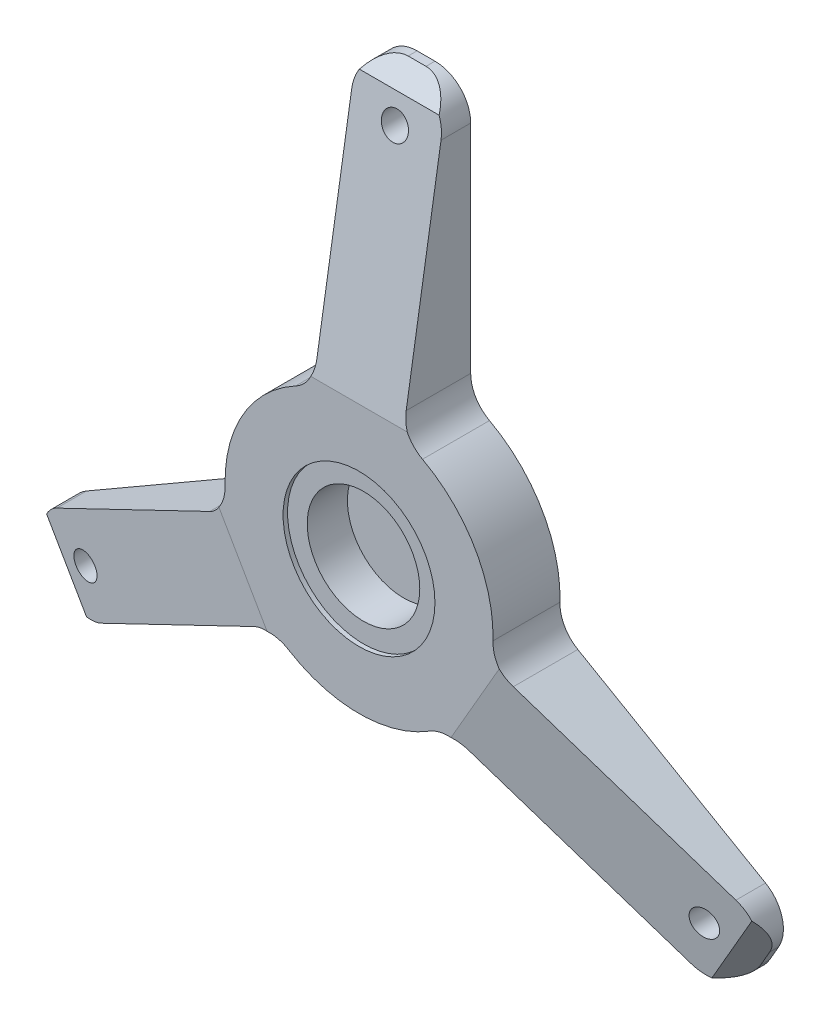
SolidWorks part; units mm, degrees
ref_plane "Спереди" through (0, 0, 0) normal (0, 0, 1) x (1, 0, 0)
ref_plane "Сверху" through (0, 0, 0) normal (0, 1, 0) x (1, 0, 0)
ref_plane "Справа" through (0, 0, 0) normal (1, 0, 0) x (0, 0, -1)
sketch "Эскиз1" plane through (0, 0, 0) normal (0, 0, 1) x (1, 0, 0)
  circle A0 centre (0, 0) radius 30
  dimension "D1" = 60
extrude "Бобышка-Вытянуть1" add sketch "Эскиз1" along normal blind 15
sketch "Эскиз2" plane through (0, 0, 0) normal (1, 0, 0) x (0, 0, -1)
  line L0 (0, 0) -> (0, 90)
  line L2 (-6, 86) -> (-15, 30)
  line L3 (-15, 30) -> (-15, 0)
  line L4 (-15, 30) -> (-15, -30) construction
  line L5 (-15, 0) -> (0, 0)
  line L6 (0, 90) -> (-2, 90)
  line L7 (-2, 90) -> (-6, 86)
  dimension "D1" = 90
  dimension "D2" = 4
  dimension "D3" = 2
  dimension "D4" = 4
extrude "Бобышка-Вытянуть2" add sketch "Эскиз2" along normal mid plane 20
sketch "Эскиз5" plane through (0, 0, 0) normal (0, 0, -1) x (-1, 0, 0)
  line L0 (0, 0) -> (0, 90) construction
  line L1 (-10, 90) -> (10, 90) construction
  circle A0 centre (0, 0) radius 80 construction
  circle A1 centre (0, 80) radius 3
  dimension "D1" = 6
  dimension "D2" = 160
extrude "Вырез-Вытянуть3" cut sketch "Эскиз5" against normal through all
pattern_circular "Круговой массив1" count 3 over 360 about axis through (0, 0, 0) along (0, 0, 1) of "Бобышка-Вытянуть2", "Вырез-Вытянуть3"
sketch "Эскиз3" plane through (0, 0, 15) normal (0, 0, 1) x (1, 0, 0)
  circle A0 centre (0, 0) radius 17
  dimension "D1" = 34
extrude "Вырез-Вытянуть1" cut sketch "Эскиз3" against normal blind 1
sketch "Эскиз4" plane through (0, 0, 15) normal (0, 0, 1) x (1, 0, 0)
  circle A0 centre (0, 0) radius 12.6
  dimension "D1" = 25.2
extrude "Вырез-Вытянуть2" cut sketch "Эскиз4" against normal blind 10
fillet "Скругление1" radius 8 12 edges at (19.4949, -22.8024, 7.5) (72.9423, -53.6603, 1) (82.9423, -36.3397, 1) (29.4949, -5.4819, 7.5) (10, 28.2843, 7.5) (-10, 90, 1) (-10, 28.2843, 7.5) (-29.4949, -5.4819, 7.5) (-82.9423, -36.3397, 1) (-72.9423, -53.6603, 1) (-19.4949, -22.8024, 7.5) (10, 90, 1)
